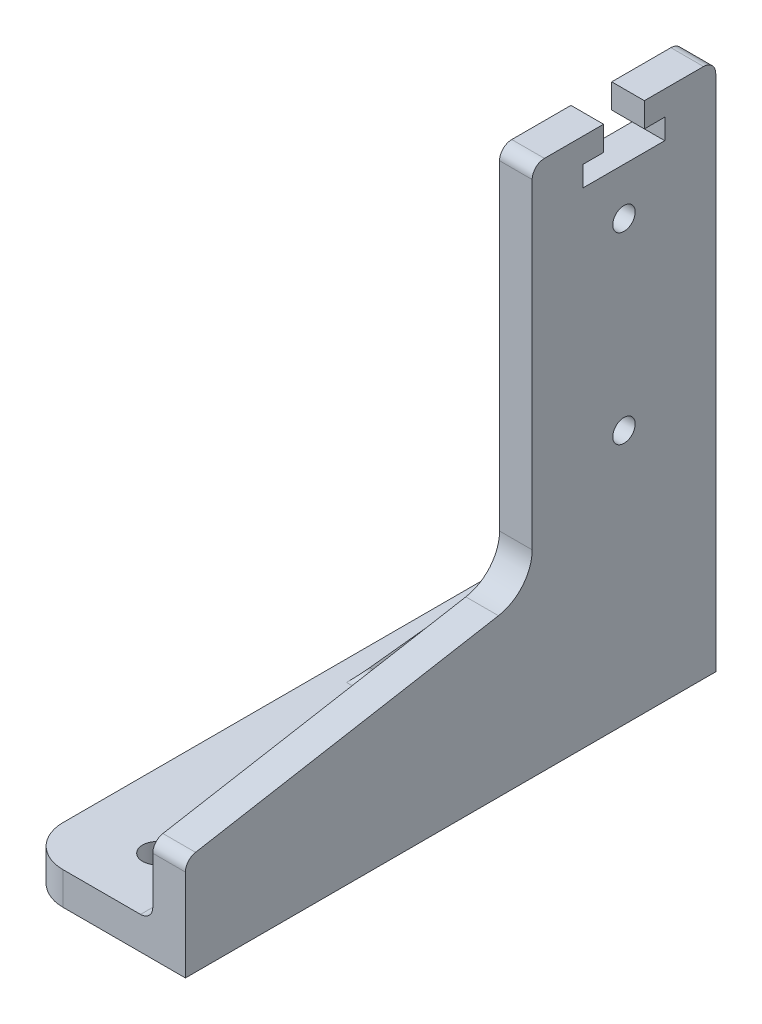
SolidWorks part; units mm, degrees
ref_plane "Plan de face" through (0, 0, 0) normal (0, 0, 1) x (1, 0, 0)
ref_plane "Plan de dessus" through (0, 0, 0) normal (0, 1, 0) x (1, 0, 0)
ref_plane "Plan de droite" through (0, 0, 0) normal (1, 0, 0) x (0, 0, -1)
sketch "Esquisse1" plane through (0, 0, 0) normal (0, 0, 1) x (1, 0, 0)
  line L0 (0, 0) -> (0, 130)
  line L1 (0, 130) -> (-8, 130)
  line L2 (-8, 130) -> (-8, 8)
  line L3 (-8, 8) -> (-40, 8)
  line L4 (-40, 8) -> (-40, 0)
  line L5 (-40, 0) -> (0, 0)
  dimension "D1" = 130
  dimension "D2" = 40
  dimension "D3" = 8
extrude "Boss.-Extru.1" add sketch "Esquisse1" along normal mid plane 130
sketch "Esquisse2" plane through (-8, 0, 0) normal (-1, 0, 0) x (0, 0, 1)
  line L0 (65, 130) -> (-65, 130) construction
  line L1 (-65, 130) -> (-65, 8) construction
  circle A0 centre (-42.5, 107.5) radius 2.75
  circle A1 centre (-42.5, 62.5) radius 2.75
  dimension "D1" = 5.5
  dimension "D2" = 45
  dimension "D3" = 22.5
  dimension "D4" = 22.5
extrude "Enlèv. mat.-Extru.1" cut sketch "Esquisse2" against normal through all
sketch "Esquisse3" plane through (0, 8, 0) normal (0, 1, 0) x (1, 0, 0)
  line L0 (-22, 50) -> (-22, -50) construction
  line L1 (0, 0) -> (-22, 0) construction
  line L2 (-40, -65) -> (-40, 65) construction
  circle A0 centre (-22, 50) radius 3.5
  circle A1 centre (-22, -50) radius 3.5
  dimension "D1" = 7
  dimension "D2" = 100
  dimension "D3" = 18
extrude "Enlèv. mat.-Extru.2" cut sketch "Esquisse3" against normal through all
sketch "Esquisse4" plane through (-8, 0, 0) normal (-1, 0, 0) x (0, 0, 1)
  line L1 (65, 130) -> (-65, 130) construction
  line L6 (-20, 130) -> (65, 130)
  line L7 (65, 130) -> (65, 25)
  line L8 (65, 130) -> (65, 8) construction
  line L9 (65, 25) -> (-20, 40)
  line L10 (-20, 40) -> (-20, 130)
  line L11 (-65, 130) -> (-65, 8) construction
  dimension "D1" = 45
  dimension "D2" = 90
  dimension "D3" = 105
extrude "Enlèv. mat.-Extru.3" cut sketch "Esquisse4" against normal through all
sketch "Esquisse6" plane through (-8, 0, 0) normal (-1, 0, 0) x (0, 0, 1)
  line L0 (-42.5, 107.5) -> (-42.5, 131.4424) construction
  line L2 (-47.5, 130) -> (-37.5, 130)
  line L3 (-52.5, 124) -> (-52.5, 119)
  line L4 (-52.5, 119) -> (-32.5, 119)
  line L5 (-32.5, 124) -> (-32.5, 119)
  line L6 (-47.5, 130) -> (-47.5, 124)
  line L7 (-47.5, 124) -> (-52.5, 124)
  line L8 (-37.5, 130) -> (-37.5, 124)
  line L9 (-37.5, 124) -> (-32.5, 124)
  line L11 (-20, 130) -> (-65, 130) construction
  dimension "D1" = 20
  dimension "D2" = 11
  dimension "D3" = 10
  dimension "D4" = 6
extrude "Enlèv. mat.-Extru.4" cut sketch "Esquisse6" against normal through all
fillet "Congé2" radius 10 3 edges at (-40, 4, -65) (-40, 4, 65) (-4, 40, -20)
ref_plane "Plan1" through (0, 0, -15) normal (0, 0, 1) x (1, 0, 0)
sketch "Esquisse5" plane through (0, 0, -15) normal (0, 0, 1) x (1, 0, 0)
  line L0 (-35, 8) -> (-8, 38)
  line L1 (-8, 8) -> (-30, 8) construction
  line L2 (-8, 130) -> (-8, 48.3898) construction
  line L3 (-40, 0) -> (-40, 8) construction
  dimension "D1" = 5
  dimension "D2" = 30
rib "Nervure2" sketch "Esquisse5" sketch "Esquisse5" thickness 5 extrusion direction parallel to sketch draft on no parameters "D1"=5
fillet "Congé1" radius 3 9 edges at (-4, 25, 65) (-4, 130, -20) (-4, 130, -65) (-8, 8, -41.25) (-8, 8, 26.25) (-8, 23, -12.5) (-8, 23, -17.5) (-21.5, 8, -17.5) (-21.5, 8, -12.5)
